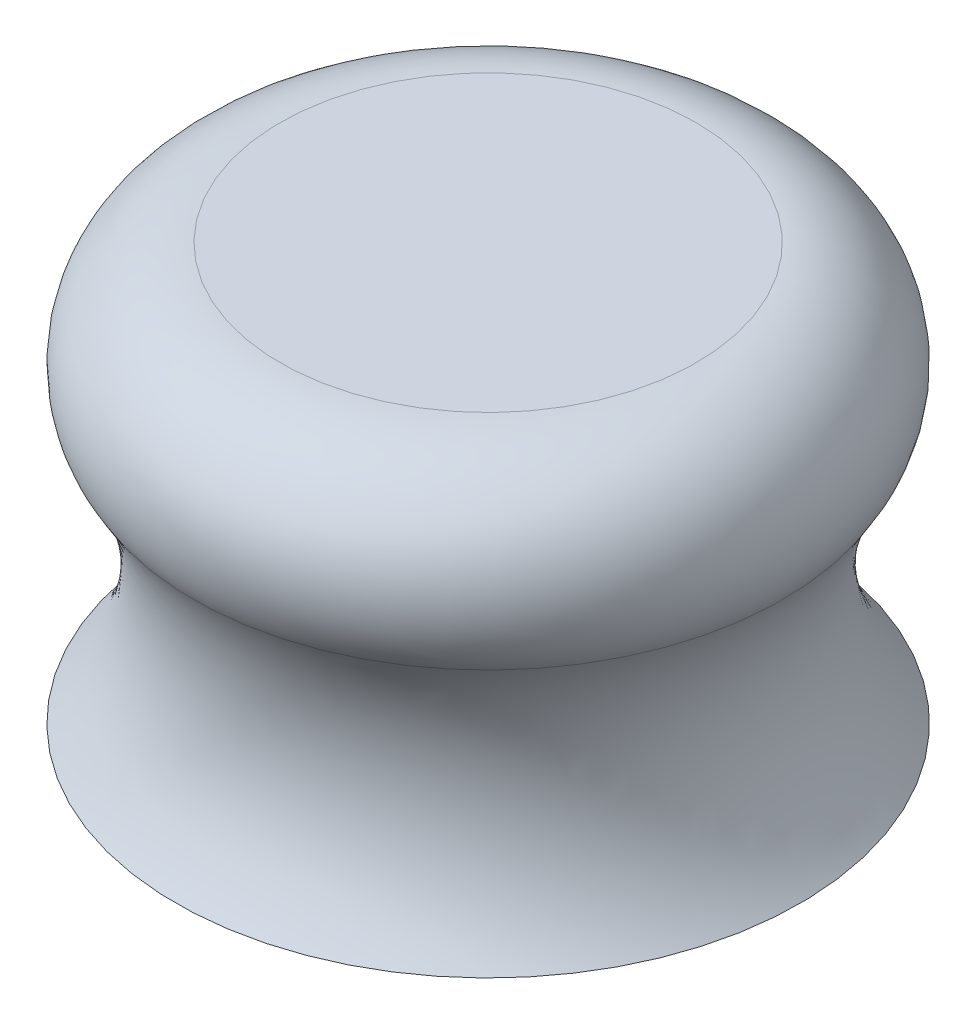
SolidWorks part; units mm, degrees
ref_plane "Płaszczyzna przednia" through (0, 0, 0) normal (0, 0, 1) x (1, 0, 0)
ref_plane "Płaszczyzna górna" through (0, 0, 0) normal (0, 1, 0) x (1, 0, 0)
ref_plane "Płaszczyzna prawa" through (0, 0, 0) normal (1, 0, 0) x (0, 0, -1)
sketch "Szkic1" plane through (0, 0, 0) normal (0, 0, 1) x (1, 0, 0)
  line L0 (0, 0) -> (0, 40)
  line L1 (0, 40) -> (20, 40)
  line L2 (0, 0) -> (30, 0)
  line L3 (0, 40) -> (0, 55.794) construction
  arc A0 (20, 40) -> (28.3095, 24.4365) centre (20, 30) cw
  arc A1 (28.3095, 24.4365) -> (30, 0) centre (44.9284, 13.3095) ccw
  dimension "D4" = 10
  dimension "D5" = 20
  dimension "D1" = 40
  dimension "D2" = 40
  dimension "D3" = 60
revolve "Obrót1" add sketch "Szkic1" angle 360 about L3
sketch "Szkic2" plane through (0, 0, 0) normal (0, 0, 1) x (1, 0, 0)
  arc A0 (-20, 40) -> (-28.3095, 24.4365) centre (-20, 30) ccw
  arc A1 (28.3095, 24.4365) -> (20, 40) centre (20, 30) ccw
  arc A2 (28.3095, 24.4365) -> (20, 40) centre (20, 30) ccw
  arc A3 (-20, 40) -> (-28.3095, 24.4365) centre (-20, 30) ccw
  arc A4 (-30, 0) -> (-28.3095, 24.4365) centre (-44.9284, 13.3095) ccw
  arc A5 (28.3095, 24.4365) -> (30, 0) centre (44.9284, 13.3095) ccw
  arc A6 (28.3095, 24.4365) -> (30, 0) centre (44.9284, 13.3095) ccw
  arc A7 (-30, 0) -> (-28.3095, 24.4365) centre (-44.9284, 13.3095) ccw
